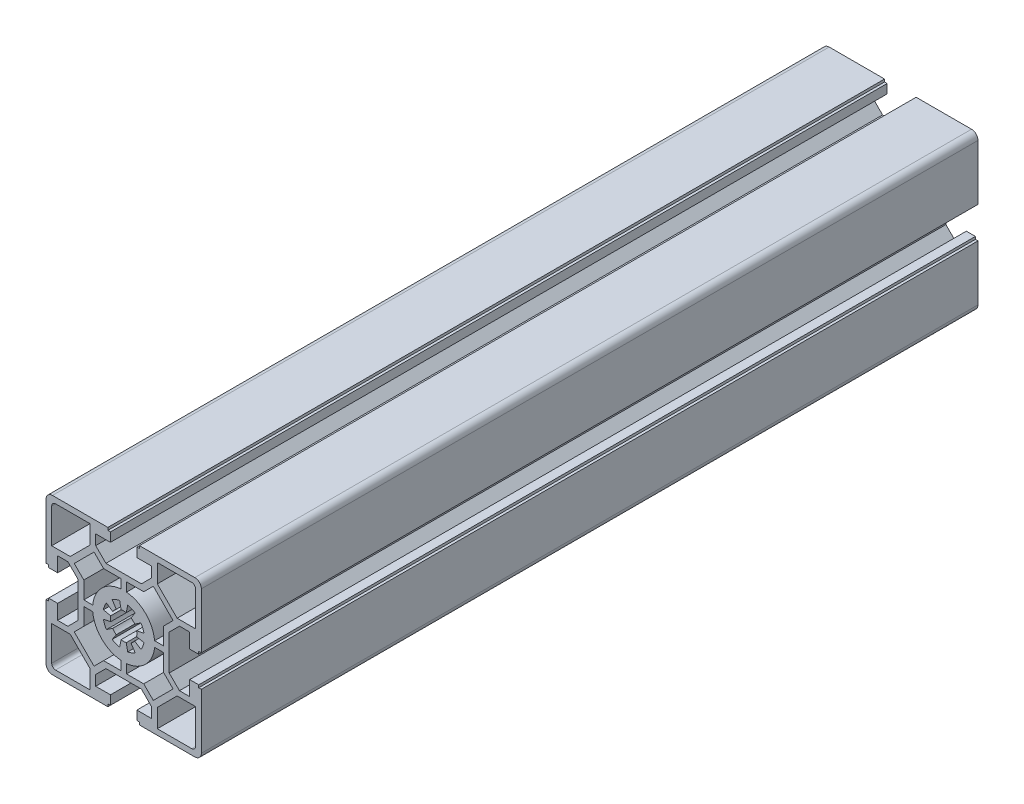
SolidWorks part; units mm, degrees
ref_plane "前视基准面" through (0, 0, 0) normal (0, 0, 1) x (1, 0, 0)
ref_plane "上视基准面" through (0, 0, 0) normal (0, 1, 0) x (1, 0, 0)
ref_plane "右视基准面" through (0, 0, 0) normal (1, 0, 0) x (0, 0, -1)
sketch "草图1" plane through (0, 0, 0) normal (0, 0, 1) x (1, 0, 0)
  line B0 (-4.2405, 2.8334) -> (-6.6518, 4.4446)
  line B1 (-7.8463, 1.5607) -> (-5.002, 0.995)
  line B2 (-5.002, -0.995) -> (-7.8463, -1.5607)
  line B3 (-6.6518, -4.4446) -> (-4.2405, -2.8334)
  line B4 (-2.8334, -4.2405) -> (-4.4446, -6.6518)
  line B5 (-1.5607, -7.8463) -> (-0.995, -5.002)
  line B6 (0.995, -5.002) -> (1.5607, -7.8463)
  line B7 (4.4446, -6.6518) -> (2.8334, -4.2405)
  line B8 (4.2405, -2.8334) -> (6.6518, -4.4446)
  line B9 (7.8463, -1.5607) -> (5.002, -0.995)
  line B10 (5.002, 0.995) -> (7.8463, 1.5607)
  line B11 (6.6518, 4.4446) -> (4.2405, 2.8334)
  line B12 (2.8334, 4.2405) -> (4.4446, 6.6518)
  line B13 (1.5607, 7.8463) -> (0.995, 5.002)
  line B14 (-0.995, 5.002) -> (-1.5607, 7.8463)
  line B15 (-4.4446, 6.6518) -> (-2.8334, 4.2405)
  line B16 (11.4444, -19.0945) -> (15.2694, -15.2694)
  line B17 (15.2694, -15.2694) -> (19.0945, -11.4444)
  line B18 (19.0945, -11.4444) -> (15.4, -7.7498)
  line B19 (15.4, -7.7498) -> (15.4, -1.1)
  line B20 (15.4, -1.1) -> (11.9495, -1.1)
  line B21 (1.1, -11.9495) -> (1.1, -15.4)
  line B22 (1.1, -15.4) -> (7.7498, -15.4)
  line B23 (7.7498, -15.4) -> (11.4444, -19.0945)
  line B24 (-15.2694, -15.2694) -> (-11.4444, -19.0945)
  line B25 (-11.4444, -19.0945) -> (-7.7498, -15.4)
  line B26 (-7.7498, -15.4) -> (-1.1, -15.4)
  line B27 (-1.1, -15.4) -> (-1.1, -11.9495)
  line B28 (-11.9495, -1.1) -> (-15.4, -1.1)
  line B29 (-15.4, -1.1) -> (-15.4, -7.7498)
  line B30 (-15.4, -7.7498) -> (-19.0945, -11.4444)
  line B31 (-19.0945, -11.4444) -> (-15.2694, -15.2694)
  line B32 (15.2694, 15.2694) -> (11.4444, 19.0945)
  line B33 (11.4444, 19.0945) -> (7.7498, 15.4)
  line B34 (7.7498, 15.4) -> (1.1, 15.4)
  line B35 (1.1, 15.4) -> (1.1, 11.9495)
  line B36 (11.9495, 1.1) -> (15.4, 1.1)
  line B37 (15.4, 1.1) -> (15.4, 7.7498)
  line B38 (15.4, 7.7498) -> (19.0945, 11.4444)
  line B39 (19.0945, 11.4444) -> (15.2694, 15.2694)
  line B40 (-7.7498, 15.4) -> (-11.4444, 19.0945)
  line B41 (-11.4444, 19.0945) -> (-15.2694, 15.2694)
  line B42 (-15.2694, 15.2694) -> (-19.0945, 11.4444)
  line B43 (-19.0945, 11.4444) -> (-15.4, 7.7498)
  line B44 (-15.4, 7.7498) -> (-15.4, 1.1)
  line B45 (-15.4, 1.1) -> (-11.9495, 1.1)
  line B46 (-1.1, 11.9495) -> (-1.1, 15.4)
  line B47 (-1.1, 15.4) -> (-7.7498, 15.4)
  line B48 (-6.85, 17.6) -> (-10.8, 21.55)
  line B49 (-10.8, 21.55) -> (-10.8, 25.5)
  line B50 (-10.8, 25.5) -> (-5.1, 25.5)
  line B51 (-5.1, 25.5) -> (-5.1, 29)
  line B52 (-5.1, 29) -> (-6.1, 29)
  line B53 (-6.1, 29) -> (-6.1, 30)
  line B54 (-6.1, 30) -> (-27.5, 30)
  line B55 (-30, 27.5) -> (-30, 6.1)
  line B56 (-30, 6.1) -> (-29, 6.1)
  line B57 (-29, 6.1) -> (-29, 5.1)
  line B58 (-29, 5.1) -> (-25.5, 5.1)
  line B59 (-25.5, 5.1) -> (-25.5, 10.8)
  line B60 (-25.5, 10.8) -> (-21.55, 10.8)
  line B61 (-21.55, 10.8) -> (-17.6, 6.85)
  line B62 (-17.6, 6.85) -> (-17.6, 0)
  line B63 (-17.6, 0) -> (-17.6, -6.85)
  line B64 (-17.6, -6.85) -> (-21.55, -10.8)
  line B65 (-21.55, -10.8) -> (-25.5, -10.8)
  line B66 (-25.5, -10.8) -> (-25.5, -5.1)
  line B67 (-25.5, -5.1) -> (-29, -5.1)
  line B68 (-29, -5.1) -> (-29, -6.1)
  line B69 (-29, -6.1) -> (-30, -6.1)
  line B70 (-30, -6.1) -> (-30, -27.5)
  line B71 (-27.5, -30) -> (-6.1, -30)
  line B72 (-6.1, -30) -> (-6.1, -29)
  line B73 (-6.1, -29) -> (-5.1, -29)
  line B74 (-5.1, -29) -> (-5.1, -25.5)
  line B75 (-5.1, -25.5) -> (-10.8, -25.5)
  line B76 (-10.8, -25.5) -> (-10.8, -21.55)
  line B77 (-10.8, -21.55) -> (-6.85, -17.6)
  line B78 (-6.85, -17.6) -> (0, -17.6)
  line B79 (0, -17.6) -> (6.85, -17.6)
  line B80 (6.85, -17.6) -> (10.8, -21.55)
  line B81 (10.8, -21.55) -> (10.8, -25.5)
  line B82 (10.8, -25.5) -> (5.1, -25.5)
  line B83 (5.1, -25.5) -> (5.1, -29)
  line B84 (5.1, -29) -> (6.1, -29)
  line B85 (6.1, -29) -> (6.1, -30)
  line B86 (6.1, -30) -> (27.5, -30)
  line B87 (30, -27.5) -> (30, -6.1)
  line B88 (30, -6.1) -> (29, -6.1)
  line B89 (29, -6.1) -> (29, -5.1)
  line B90 (29, -5.1) -> (25.5, -5.1)
  line B91 (25.5, -5.1) -> (25.5, -10.8)
  line B92 (25.5, -10.8) -> (21.55, -10.8)
  line B93 (21.55, -10.8) -> (17.6, -6.85)
  line B94 (17.6, -6.85) -> (17.6, 0)
  line B95 (17.6, 0) -> (17.6, 6.85)
  line B96 (17.6, 6.85) -> (21.55, 10.8)
  line B97 (21.55, 10.8) -> (25.5, 10.8)
  line B98 (25.5, 10.8) -> (25.5, 5.1)
  line B99 (25.5, 5.1) -> (29, 5.1)
  line B100 (29, 5.1) -> (29, 6.1)
  line B101 (29, 6.1) -> (30, 6.1)
  line B102 (30, 6.1) -> (30, 27.5)
  line B103 (27.5, 30) -> (6.1, 30)
  line B104 (6.1, 30) -> (6.1, 29)
  line B105 (6.1, 29) -> (5.1, 29)
  line B106 (5.1, 29) -> (5.1, 25.5)
  line B107 (5.1, 25.5) -> (10.8, 25.5)
  line B108 (10.8, 25.5) -> (10.8, 21.55)
  line B109 (10.8, 21.55) -> (6.85, 17.6)
  line B110 (6.85, 17.6) -> (0, 17.6)
  line B111 (0, 17.6) -> (-6.85, 17.6)
  line B112 (27.8, -26.3) -> (27.8, -13)
  line B113 (27.8, -13) -> (20.6502, -13)
  line B114 (20.6502, -13) -> (16.8251, -16.8251)
  line B115 (16.8251, -16.8251) -> (13, -20.6502)
  line B116 (13, -20.6502) -> (13, -27.8)
  line B117 (13, -27.8) -> (26.3, -27.8)
  line B118 (-26.3, -27.8) -> (-13, -27.8)
  line B119 (-13, -27.8) -> (-13, -20.6502)
  line B120 (-13, -20.6502) -> (-16.8251, -16.8251)
  line B121 (-16.8251, -16.8251) -> (-20.6502, -13)
  line B122 (-20.6502, -13) -> (-27.8, -13)
  line B123 (-27.8, -13) -> (-27.8, -26.3)
  line B124 (13, 20.6502) -> (16.8251, 16.8251)
  line B125 (16.8251, 16.8251) -> (20.6502, 13)
  line B126 (20.6502, 13) -> (27.8, 13)
  line B127 (27.8, 13) -> (27.8, 26.3)
  line B128 (26.3, 27.8) -> (13, 27.8)
  line B129 (13, 27.8) -> (13, 20.6502)
  line B130 (-27.8, 26.3) -> (-27.8, 13)
  line B131 (-27.8, 13) -> (-20.6502, 13)
  line B132 (-20.6502, 13) -> (-16.8251, 16.8251)
  line B133 (-16.8251, 16.8251) -> (-13, 20.6502)
  line B134 (-13, 20.6502) -> (-13, 27.8)
  line B135 (-13, 27.8) -> (-26.3, 27.8)
  arc B136 (-2.8334, 4.2405) -> (-3.6062, 3.6062) centre (0, 0) ccw
  arc B137 (-3.6062, 3.6062) -> (-4.2405, 2.8334) centre (0, 0) ccw
  arc B138 (-6.6518, 4.4446) -> (-7.8463, 1.5607) centre (0, 0) ccw
  arc B139 (-5.002, 0.995) -> (-5.1, 0) centre (0, 0) ccw
  arc B140 (-5.1, 0) -> (-5.002, -0.995) centre (0, 0) ccw
  arc B141 (-7.8463, -1.5607) -> (-6.6518, -4.4446) centre (0, 0) ccw
  arc B142 (-4.2405, -2.8334) -> (-3.6062, -3.6062) centre (0, 0) ccw
  arc B143 (-3.6062, -3.6062) -> (-2.8334, -4.2405) centre (0, 0) ccw
  arc B144 (-4.4446, -6.6518) -> (-1.5607, -7.8463) centre (0, 0) ccw
  arc B145 (-0.995, -5.002) -> (0, -5.1) centre (0, 0) ccw
  arc B146 (0, -5.1) -> (0.995, -5.002) centre (0, 0) ccw
  arc B147 (1.5607, -7.8463) -> (4.4446, -6.6518) centre (0, 0) ccw
  arc B148 (2.8334, -4.2405) -> (3.6062, -3.6062) centre (0, 0) ccw
  arc B149 (3.6062, -3.6062) -> (4.2405, -2.8334) centre (0, 0) ccw
  arc B150 (6.6518, -4.4446) -> (7.8463, -1.5607) centre (0, 0) ccw
  arc B151 (5.002, -0.995) -> (5.1, 0) centre (0, 0) ccw
  arc B152 (5.1, 0) -> (5.002, 0.995) centre (0, 0) ccw
  arc B153 (7.8463, 1.5607) -> (6.6518, 4.4446) centre (0, 0) ccw
  arc B154 (4.2405, 2.8334) -> (3.6062, 3.6062) centre (0, 0) ccw
  arc B155 (3.6062, 3.6062) -> (2.8334, 4.2405) centre (0, 0) ccw
  arc B156 (4.4446, 6.6518) -> (1.5607, 7.8463) centre (0, 0) ccw
  arc B157 (0.995, 5.002) -> (0, 5.1) centre (0, 0) ccw
  arc B158 (0, 5.1) -> (-0.995, 5.002) centre (0, 0) ccw
  arc B159 (-1.5607, 7.8463) -> (-4.4446, 6.6518) centre (0, 0) ccw
  arc B160 (8.4853, -8.4853) -> (11.9495, -1.1) centre (0, 0) ccw
  arc B161 (1.1, -11.9495) -> (8.4853, -8.4853) centre (0, 0) ccw
  arc B162 (-8.4853, -8.4853) -> (-1.1, -11.9495) centre (0, 0) ccw
  arc B163 (-11.9495, -1.1) -> (-8.4853, -8.4853) centre (0, 0) ccw
  arc B164 (8.4853, 8.4853) -> (1.1, 11.9495) centre (0, 0) ccw
  arc B165 (11.9495, 1.1) -> (8.4853, 8.4853) centre (0, 0) ccw
  arc B166 (-8.4853, 8.4853) -> (-11.9495, 1.1) centre (0, 0) ccw
  arc B167 (-1.1, 11.9495) -> (-8.4853, 8.4853) centre (0, 0) ccw
  arc B168 (-27.5, 30) -> (-30, 27.5) centre (-27.5, 27.5) ccw
  arc B169 (-30, -27.5) -> (-27.5, -30) centre (-27.5, -27.5) ccw
  arc B170 (27.5, -30) -> (30, -27.5) centre (27.5, -27.5) ccw
  arc B171 (30, 27.5) -> (27.5, 30) centre (27.5, 27.5) ccw
  arc B172 (26.3, -27.8) -> (27.8, -26.3) centre (26.3, -26.3) ccw
  arc B173 (-27.8, -26.3) -> (-26.3, -27.8) centre (-26.3, -26.3) ccw
  arc B174 (27.8, 26.3) -> (26.3, 27.8) centre (26.3, 26.3) ccw
  arc B175 (-26.3, 27.8) -> (-27.8, 26.3) centre (-26.3, 26.3) ccw
sketch_block_instance "A$C6E2E7415-1"
sketch_block "A$C6E2E7415"
extrude "凸台-拉伸1" add sketch "草图1" along normal mid plane 300
